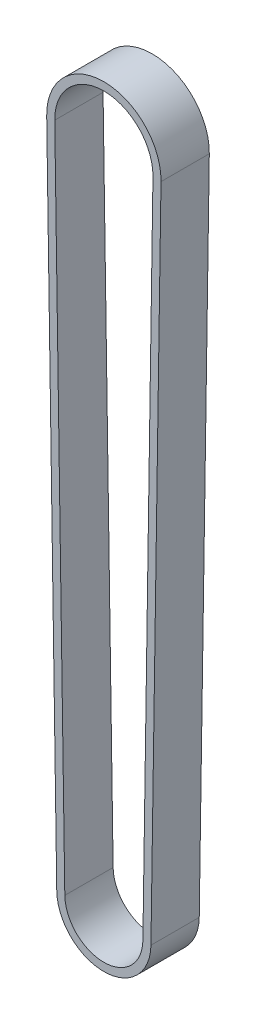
SolidWorks part; units mm, degrees
ref_plane "Спереди" through (0, 0, 0) normal (0, 0, 1) x (1, 0, 0)
ref_plane "Сверху" through (0, 0, 0) normal (0, 1, 0) x (1, 0, 0)
ref_plane "Справа" through (0, 0, 0) normal (1, 0, 0) x (0, 0, -1)
sketch "Эскиз1" plane through (0, 0, 0) normal (0, 0, 1) x (1, 0, 0)
  line L0 (6.0993, 82.6982) -> (4.8494, -0.0732)
  line L1 (-6.0993, 82.6982) -> (-4.8494, -0.0732)
  line L2 (0, 0) -> (0, 82.2577) construction
  line L3 (-7.0992, 82.6831) -> (-5.8493, -0.0883)
  line L4 (7.0992, 82.6831) -> (5.8493, -0.0883)
  arc A0 (-4.8494, -0.0732) -> (4.8494, -0.0732) centre (0, 0) ccw
  arc A1 (6.0993, 82.6982) -> (-6.0993, 82.6982) centre (0, 82.7903) ccw
  arc A2 (7.0992, 82.6831) -> (-7.0992, 82.6831) centre (0, 82.7903) ccw
  arc A3 (-5.8493, -0.0883) -> (5.8493, -0.0883) centre (0, 0) ccw
  dimension "D1" = 6.1
  dimension "D2" = 4.85
  dimension "D3" = 200
  dimension "D4" = 1
extrude "Бобышка-Вытянуть1" add sketch "Эскиз1" along normal blind 6
